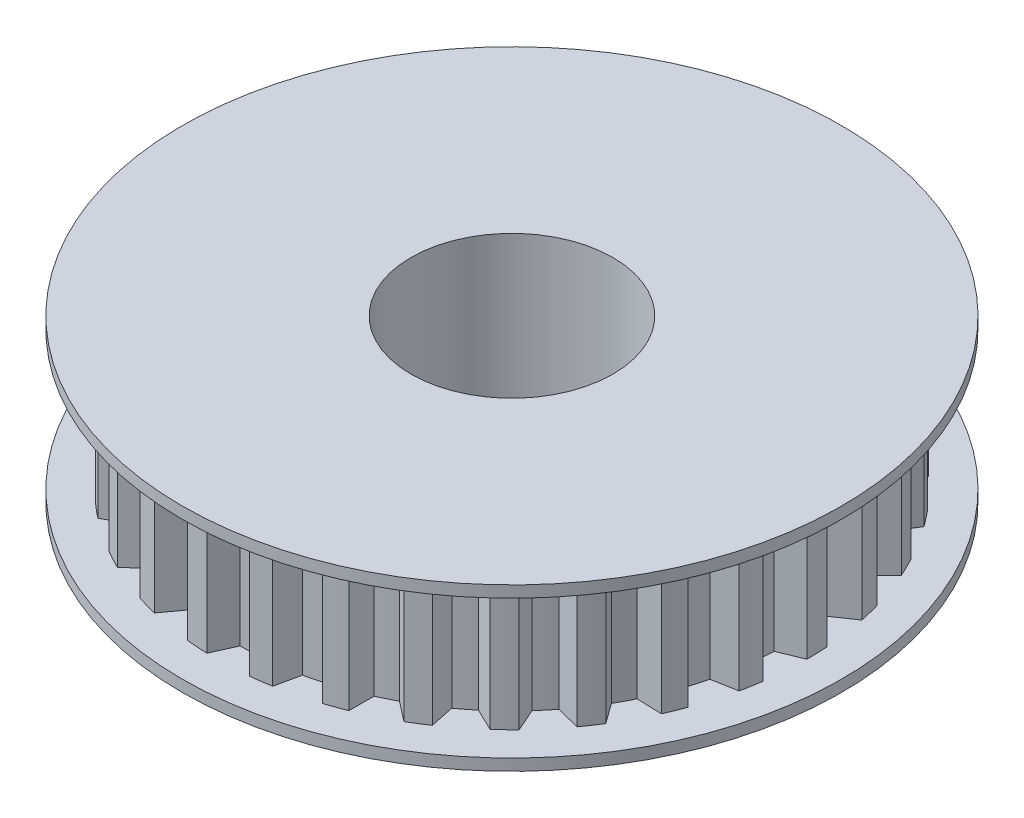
SolidWorks part; units mm, degrees
ref_plane "Front Plane" through (0, 0, 0) normal (0, 0, 1) x (1, 0, 0)
ref_plane "Top Plane" through (0, 0, 0) normal (0, 1, 0) x (1, 0, 0)
ref_plane "Right Plane" through (0, 0, 0) normal (1, 0, 0) x (0, 0, -1)
imported_body "Imported3"
ref_plane "Plane1" through (0, 0, 0) normal (0, 0, -1) x (-1, 0, 0)
sketch "Sketch1" plane through (0, 0, 0) normal (0, 0, -1) x (-1, 0, 0)
  line L0 (-8.7586, 0) -> (0, 0)
  line L1 (0, 0) -> (0, 14)
  line L2 (0, 14) -> (-8.7586, 14)
  line L3 (-8.7586, 14) -> (-8.7586, 0)
  line L4 (0, 0) -> (0, 14) construction
revolve "Cut-Revolve1" cut sketch "Sketch1" angle 360 about L4
